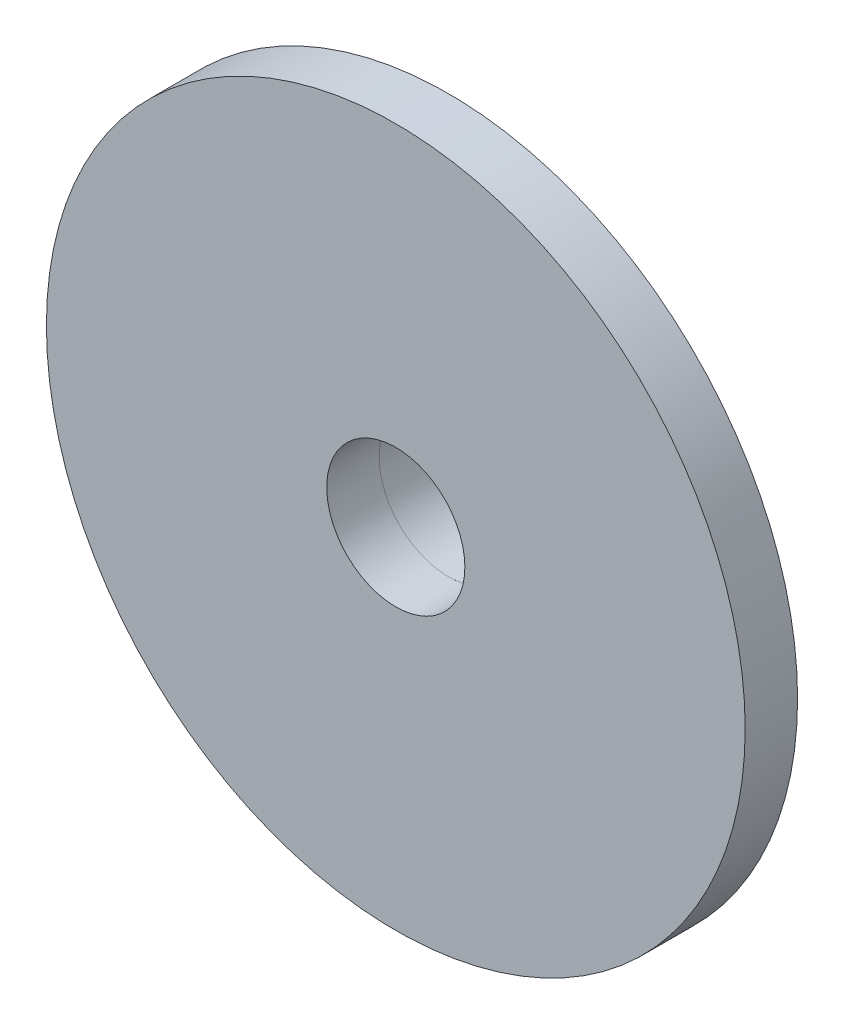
SolidWorks part; units mm, degrees
ref_plane "Plan de face" through (0, 0, 0) normal (0, 0, 1) x (1, 0, 0)
ref_plane "Plan de dessus" through (0, 0, 0) normal (0, 1, 0) x (1, 0, 0)
ref_plane "Plan de droite" through (0, 0, 0) normal (1, 0, 0) x (0, 0, -1)
sketch "Esquisse1" plane through (0, 0, 0) normal (0, 0, 1) x (1, 0, 0)
  circle A0 centre (0, 0) radius 6.5
  circle A1 centre (0, 0) radius 2
  dimension "D1" = 13
  dimension "D2" = 4
extrude "Extrusion1" add sketch "Esquisse1" along normal blind 1.5
sketch "Esquisse3" plane through (0, 0, 1.5) normal (0, 0, 1) x (1, 0, 0)
  circle A0 centre (0, 0) radius 1.977
  circle A1 centre (0, 0) radius 10
  dimension "D1" = 20
extrude "Extrusion2" add sketch "Esquisse3" along normal blind 1.5
